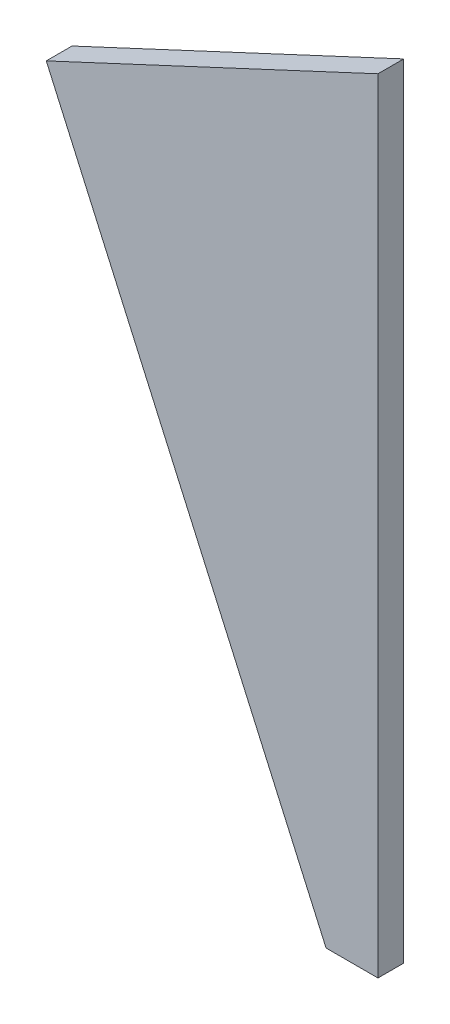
SolidWorks part; units mm, degrees
ref_plane "Front Plane" through (0, 0, 0) normal (0, 0, 1) x (1, 0, 0)
ref_plane "Top Plane" through (0, 0, 0) normal (0, 1, 0) x (1, 0, 0)
ref_plane "Right Plane" through (0, 0, 0) normal (1, 0, 0) x (0, 0, -1)
sketch "Sketch1" plane through (0, 0, 0) normal (0, 0, 1) x (1, 0, 0)
  line L0 (-40.8826, 92.005) -> (-6.3969, 14.5488)
  line L1 (0, 14.5488) -> (0, 111.0688)
  line L2 (0, 111.0688) -> (-40.8826, 92.005)
  line L3 (0, 14.5488) -> (-6.3969, 14.5488)
  dimension "D1" = 24
  dimension "D2" = 96.52
extrude "Boss-Extrude1" add sketch "Sketch1" against normal blind 3.175
